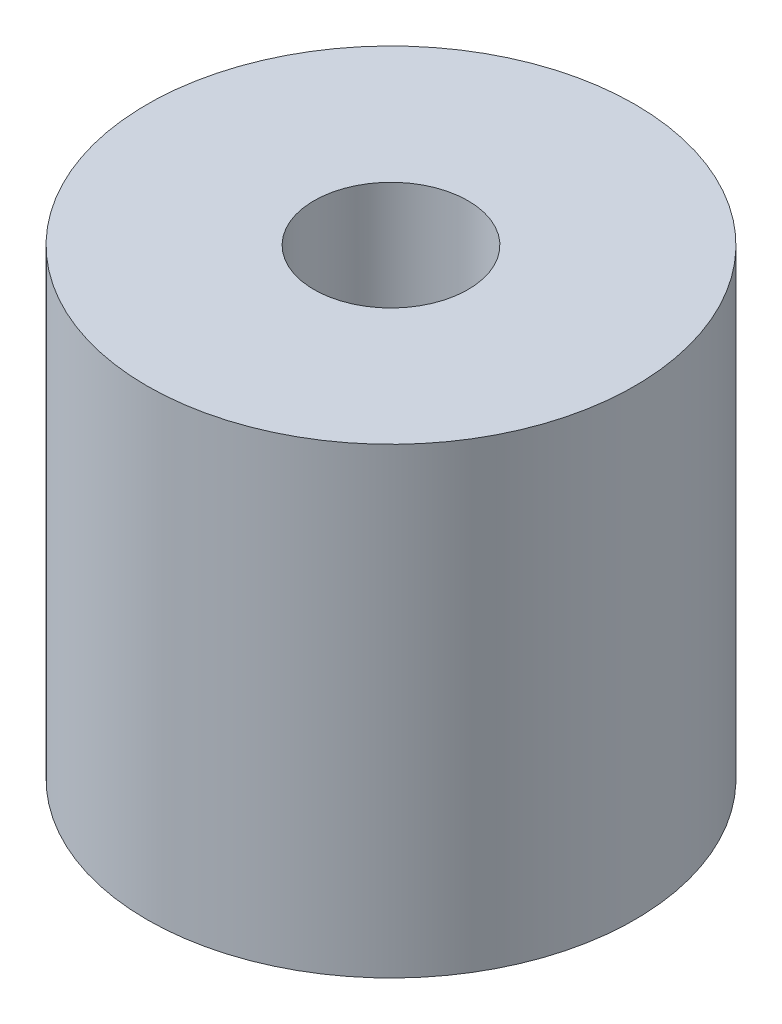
SolidWorks part; units mm, degrees
ref_plane "Front Plane" through (0, 0, 0) normal (0, 0, 1) x (1, 0, 0)
ref_plane "Top Plane" through (0, 0, 0) normal (0, 1, 0) x (1, 0, 0)
ref_plane "Right Plane" through (0, 0, 0) normal (1, 0, 0) x (0, 0, -1)
sketch "Sketch1" plane through (0, 0, 0) normal (0, 1, 0) x (1, 0, 0)
  circle A0 centre (0, 0) radius 9.5
  dimension "D1" = 19
extrude "Boss-Extrude1" add sketch "Sketch1" along normal blind 18
sketch "Sketch2" plane through (0, 0, 0) normal (0, -1, 0) x (1, 0, 0)
  circle A0 centre (0, 0) radius 3
  dimension "D1" = 6
extrude "Cut-Extrude1" cut sketch "Sketch2" against normal through all both and the other way through all
